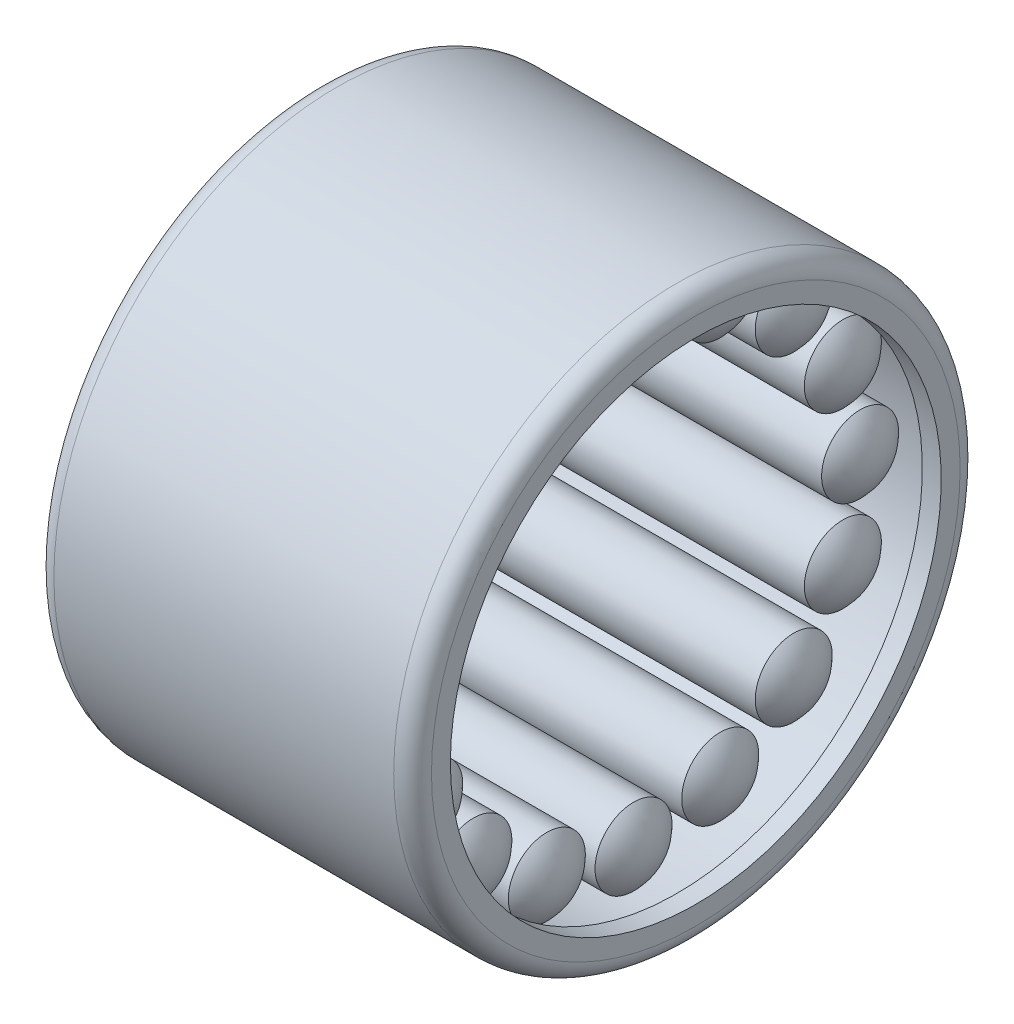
SolidWorks part; units mm, degrees
ref_plane "Plan1" through (0, 0, 0) normal (0, 0, 1) x (1, 0, 0)
ref_plane "Plan2" through (0, 0, 0) normal (0, 1, 0) x (1, 0, 0)
ref_plane "Plan3" through (0, 0, 0) normal (1, 0, 0) x (0, 0, -1)
sketch "Esquisse1" plane through (0, 0, 0) normal (0, 0, 1) x (1, 0, 0)
  line L0 (0, 0) -> (26, 0) construction
  line L1 (0, 0) -> (0, 1)
  line L2 (0, 1) -> (-0.2, 1)
  line L3 (-0.2, 1) -> (-0.2, 4)
  line L4 (-0.2, 4) -> (0, 4)
  line L5 (0, 4) -> (0, 5.5)
  line L6 (0, 5.5) -> (-0.2, 5.5)
  line L7 (-0.2, 5.5) -> (-0.2, 7)
  line L8 (0.3, 7.5) -> (9.3, 7.5)
  line L9 (0.3, 7) -> (0.3, 5.5)
  line L11 (0.3, 5.5) -> (0.5, 5.5)
  line L13 (0.5, 5.5) -> (0.5, 4)
  line L14 (0.5, 4) -> (0.3, 4)
  line L15 (0.3, 4) -> (0.3, 1)
  line L16 (0.3, 1) -> (0.5, 1)
  line L17 (0.5, 1) -> (0.5, 0)
  line L18 (0.5, 0) -> (0, 0)
  line L19 (9.8, 7) -> (9.8, 6.5)
  line L20 (9.8, 6.5) -> (9.3, 6.5)
  line L21 (9.3, 6.5) -> (9.3, 7)
  line L22 (9.3, 7) -> (0.3, 7)
  arc A0 (9.8, 7) -> (9.3, 7.5) centre (9.3, 7) ccw
  arc A1 (0.3, 7.5) -> (-0.2, 7) centre (0.3, 7) ccw
  dimension "D3" = 0.5
  dimension "D11" = 0.5
  dimension "D1" = 7.5
  dimension "D2" = 0.2
  dimension "D4" = 1
  dimension "D5" = 4
  dimension "D6" = 5.5
  dimension "D7" = 0.2
  dimension "D8" = 0.5
  dimension "D9" = 0.5
  dimension "D10" = 10
revolve "Base-Révolution" add sketch "Esquisse1" angle 360 about L0
sketch "Esquisse2" plane through (0, 0, 0) normal (0, 0, 1) x (1, 0, 0)
  line L0 (1, 6) -> (9, 6) construction
  line L1 (1.0204, 7.02) -> (8.1512, 7.02)
  line L3 (4.5858, 7.02) -> (4.5858, 3.6169) construction
  line L5 (8.5858, 6) -> (0.5858, 6)
  arc A0 (1.0204, 7.02) -> (0.5858, 6) centre (2, 6) ccw
  arc A1 (8.1512, 7.02) -> (8.5858, 6) centre (7.1716, 6) cw
  dimension "D1" = 7.02
  dimension "D2" = 6
  dimension "D3" = 8
revolve "Boss.-Révol.2" add sketch "Esquisse2" angle 360 about L0
pattern_circular "Répétition circulaire1" count 16 every 22.5 about axis through (0, 0, 0) along (1, 0, 0)
